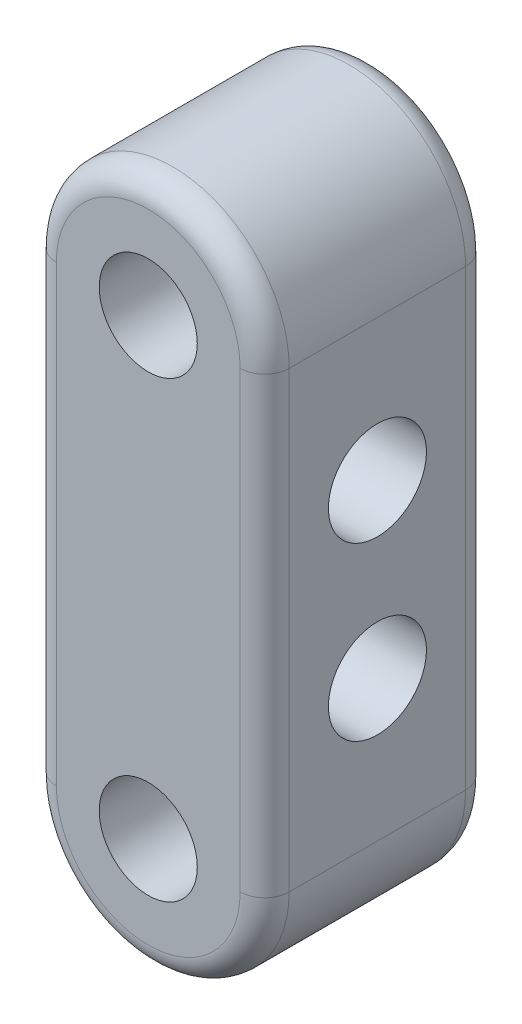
SolidWorks part; units mm, degrees
ref_plane "Face" through (0, 0, 0) normal (0, 0, 1) x (1, 0, 0)
ref_plane "Dessus" through (0, 0, 0) normal (0, 1, 0) x (1, 0, 0)
ref_plane "Droite" through (0, 0, 0) normal (1, 0, 0) x (0, 0, -1)
sketch "Esquisse1" plane through (0, 0, 0) normal (0, 0, 1) x (1, 0, 0)
  line L0 (0, 0) -> (0, 18.5)
  line L2 (9.5, 18.5) -> (9.5, 0)
  arc A0 (9.5, 18.5) -> (0, 18.5) centre (4.75, 18.5) ccw
  arc A1 (9.5, 0) -> (0, 0) centre (4.75, 0) cw
  dimension "D1" = 4.75
  dimension "D2" = 18.5
extrude "Base-Extrusion" add sketch "Esquisse1" along normal blind 9.2
sketch "Esquisse2" plane through (0, 0, 9.2) normal (0, 0, 1) x (1, 0, 0)
  circle A0 centre (4.75, 18.5) radius 2
  circle A1 centre (4.75, 0) radius 2
  arc A2 (9.5, 18.5) -> (0, 18.5) centre (4.75, 18.5) ccw construction
  arc A3 (0, 0) -> (9.5, 0) centre (4.75, 0) ccw construction
  dimension "D1" = 4
  dimension "D2" = 4
extrude "Enlèv. mat.-Extru.1" cut sketch "Esquisse2" against normal through all
fillet "Congé1" radius 1
fillet "Congé2" radius 1
sketch "Esquisse3" plane through (9.5, 0, 0) normal (1, 0, 0) x (0, 0, -1)
  line L0 (-1, 23.25) -> (-8.2, 23.25) construction
  line L1 (-9.2, 0) -> (-9.2, 18.5) construction
  line L3 (-8.2, -4.75) -> (-1, -4.75) construction
  circle A0 centre (-4.6, 12.75) radius 2
  circle A1 centre (-4.6, 5.75) radius 2
  dimension "D4" = 4
  dimension "D5" = 4
  dimension "D1" = 10.5
  dimension "D2" = 4.6
  dimension "D3" = 10.5
extrude "Enlèv. mat.-Extru.2" cut sketch "Esquisse3" against normal through all
